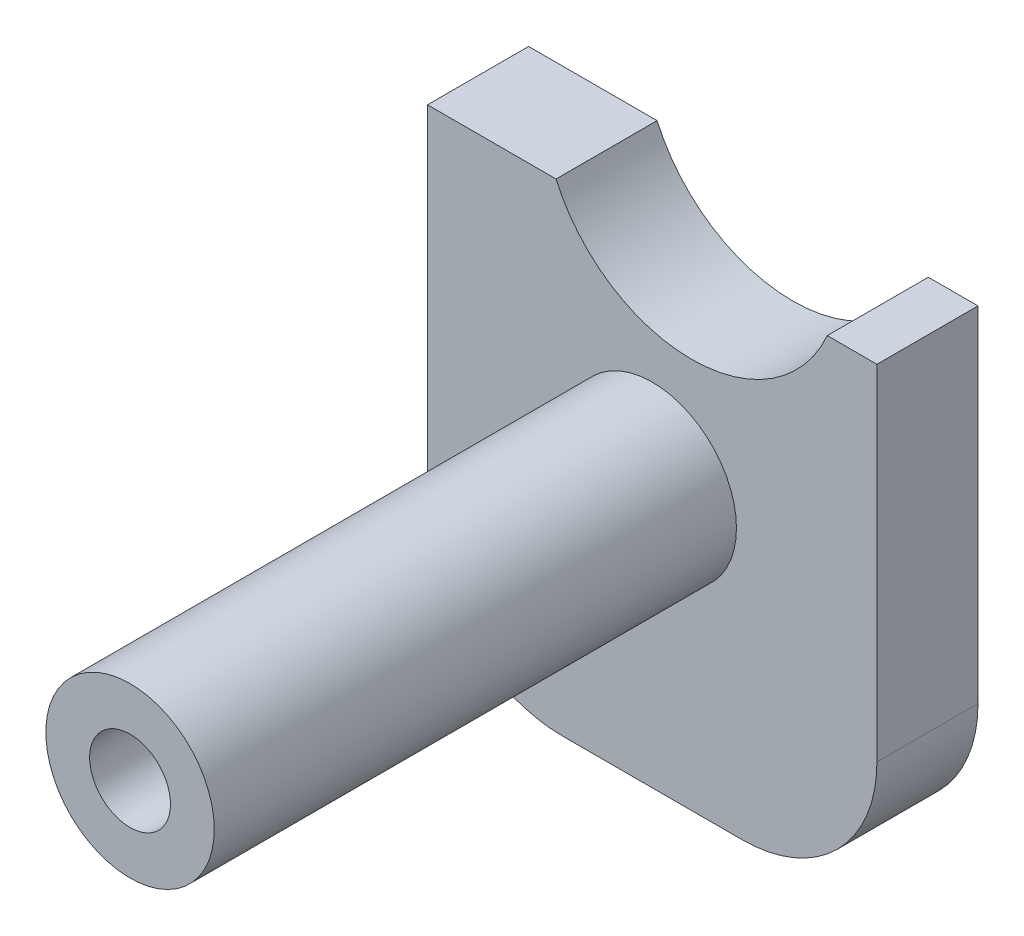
SolidWorks part; units mm, degrees
ref_plane "Plan de face" through (0, 0, 0) normal (0, 0, 1) x (1, 0, 0)
ref_plane "Plan de dessus" through (0, 0, 0) normal (0, 1, 0) x (1, 0, 0)
ref_plane "Plan de droite" through (0, 0, 0) normal (1, 0, 0) x (0, 0, -1)
sketch "Esquisse1" plane through (0, 0, 0) normal (0, 0, 1) x (1, 0, 0)
  line L2 (23.83, -12.6621) -> (23.83, -21.6633) construction
  line L3 (21.16, -20.5921) -> (26.5, -20.5921)
  line L4 (30.5, -16.5921) -> (30.5, 24.4079)
  line L5 (-26.5, -20.5921) -> (26.5, -20.5921)
  line L6 (30.5, -6.3682) -> (30.5, -16.5921)
  line L7 (30.5, -6.3682) -> (29.0256, -6.3682)
  line L8 (17.16, -6.3682) -> (20.9744, -6.3682)
  line L9 (17.16, -6.3682) -> (17.16, -16.5921)
  circle A0 centre (23.83, -12.6621) radius 1.2
  arc A3 (21.16, -20.5921) -> (17.16, -16.5921) centre (21.16, -16.5921) cw
  arc A4 (26.5, -20.5921) -> (30.5, -16.5921) centre (26.5, -16.5921) ccw
  arc A5 (26.5, -20.5921) -> (30.5, -16.5921) centre (26.5, -16.5921) ccw
  arc A6 (20.9744, -6.3682) -> (29.0256, -6.3682) centre (25, -4.5921) ccw
  dimension "D1" = 0
  dimension "D2" = 4.4
  dimension "D3" = 2.4
extrude "Extrusion1" add sketch "Esquisse1" along normal blind 3
sketch "Esquisse2" plane through (0, 0, 3) normal (0, 0, 1) x (1, 0, 0)
  circle A0 centre (23.83, -12.6621) radius 1.2
  circle A1 centre (23.83, -12.6621) radius 2.5
  dimension "D1" = 5
  dimension "D2" = 2.4
extrude "Extrusion2" add sketch "Esquisse2" along normal blind 15.5
